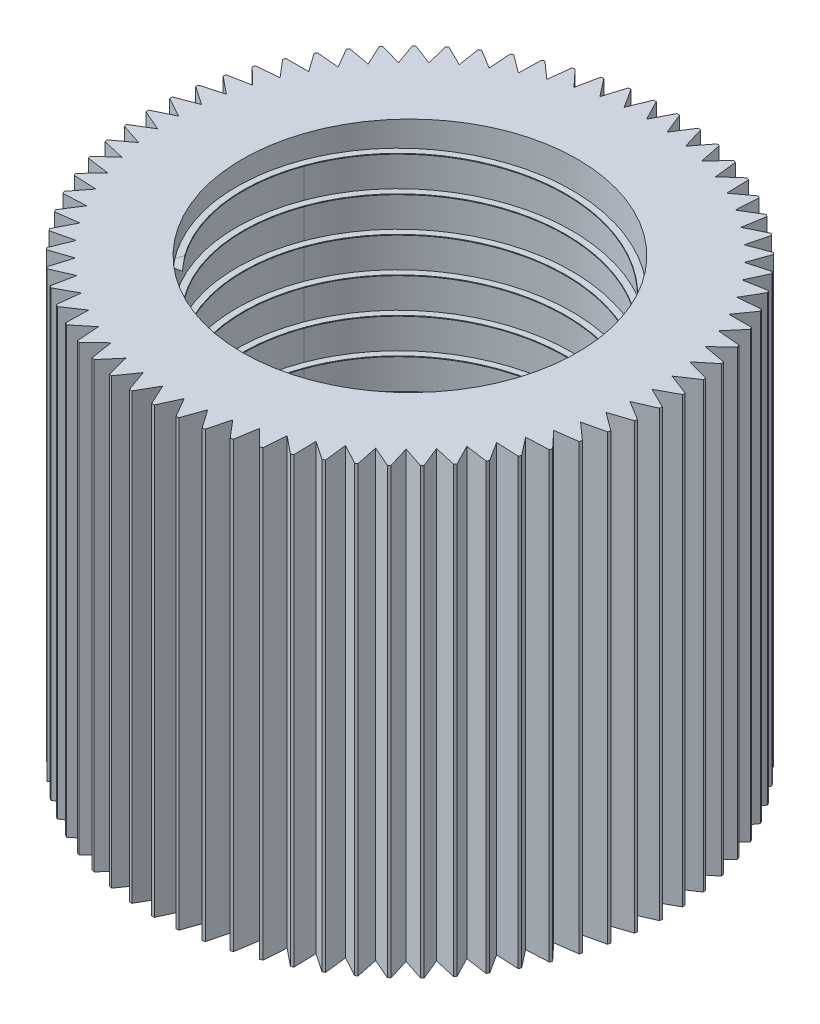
SolidWorks part; units mm, degrees
ref_plane "Front Plane" through (0, 0, 0) normal (0, 0, 1) x (1, 0, 0)
ref_plane "Top Plane" through (0, 0, 0) normal (0, 1, 0) x (1, 0, 0)
ref_plane "Right Plane" through (0, 0, 0) normal (1, 0, 0) x (0, 0, -1)
sketch "Sketch1" plane through (0, 0, 0) normal (0, 1, 0) x (1, 0, 0)
  circle A0 centre (0, 0) radius 2.4257
  circle A1 centre (0, 0) radius 3.7211
  dimension "D1" = 4.8514
  dimension "D2" = 7.4422
extrude "Boss-Extrude1" add sketch "Sketch1" along normal blind 6.4262
sketch "Sketch3" plane through (0, 6.4262, 0) normal (0, 1, 0) x (1, 0, 0)
  line L0 (0, 5.0131) -> (0, -4.408) construction
  line L1 (-0.2239, 3.8599) -> (0, 3.4274)
  line L2 (0, 3.4274) -> (0.2239, 3.8599)
  line L3 (0.2239, 3.8599) -> (-0.2239, 3.8599)
extrude "Cut-Extrude1" cut sketch "Sketch3" against normal blind 6.4262 contours L3 L1 L2
pattern_circular "CirPattern1" count 69 over 360 about axis through (0, 0, 0) along (0, 1, 0) of "Cut-Extrude1"
sketch "Sketch4" plane through (0, 0, 0) normal (0, -1, 0) x (1, 0, 0)
  circle A2 centre (0, 0) radius 2.6797
  circle A3 centre (0, 0) radius 2.6797
  dimension "D1" = 0.254
curve "Helix/Spiral1"
sketch "Sketch5" plane through (0, 0, 0) normal (0, -1, 0) x (1, 0, 0)
  line L0 (-2.4768, -0.7278) -> (-2.2725, -0.5235)
  line L1 (-2.2725, -0.5235) -> (-2.1965, -0.7877)
  line L2 (-2.1965, -0.7877) -> (-2.4768, -0.7278)
sweep "Sweep1" add profiles "Sketch5" path "Helix/Spiral1"
